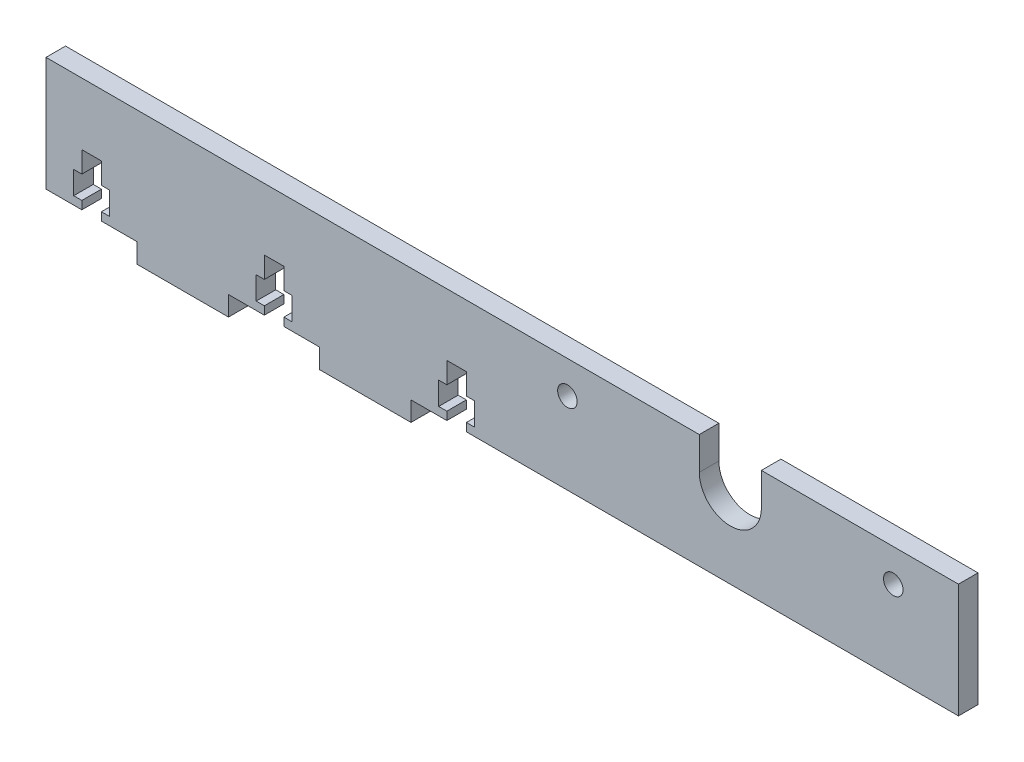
SolidWorks part; units mm, degrees
ref_plane "Front Plane" through (0, 0, 0) normal (0, 0, 1) x (1, 0, 0)
ref_plane "Top Plane" through (0, 0, 0) normal (0, 1, 0) x (1, 0, 0)
ref_plane "Right Plane" through (0, 0, 0) normal (1, 0, 0) x (0, 0, -1)
sketch "Sketch1" plane through (0, 0, 0) normal (0, 0, 1) x (1, 0, 0)
  line L1 (-35, -12.5) -> (35, -12.5)
  line L2 (-35, -12.5) -> (-35, 12.5)
  line L3 (-35, 12.5) -> (35, 12.5)
  line L4 (35, -12.5) -> (35, 12.5)
  line L5 (-35, -12.5) -> (35, 12.5) construction
  line L6 (-35, 12.5) -> (35, -12.5) construction
  line L7 (-35, 12.5) -> (35, 12.5)
  line L8 (-35, 12.5) -> (-35, 27.5)
  line L9 (-35, 27.5) -> (35, 27.5)
  line L10 (35, 12.5) -> (35, 27.5)
  line L11 (-5, 20) -> (5, 20)
  line L12 (-5, 20) -> (-5, 13)
  line L13 (-5, 13) -> (5, 13)
  line L14 (5, 20) -> (5, 13)
  line L15 (-5, 20) -> (5, 13) construction
  line L16 (-5, 13) -> (5, 20) construction
  circle A0 centre (0, 0) radius 4.7625
  circle A1 centre (-25, 0) radius 1.5
  circle A2 centre (25, 0) radius 1.5
  point P11 (0, 16.5)
  dimension "D1" = 9.525
  dimension "D2" = 3
  dimension "D3" = 3
  dimension "D6" = 25
  dimension "D4" = 25
  dimension "D5" = 70
  dimension "D7" = 25
  dimension "D8" = 15
  dimension "D9" = 10
  dimension "D10" = 7
  dimension "D11" = 20
extrude "Boss-Extrude1" add sketch "Sketch1" along normal blind 3 contours L1 L4 L3 L2 A2 A1 A0 | L3 L10 L9 L8 L11 L14 L13 L12
sketch "Sketch2" plane through (0, 0, 3) normal (0, 0, 1) x (1, 0, 0)
  point P26 (-21, 7)
other "Block1-1"
sketch_block "Block1" parameters "D7"=3, "D13"=3, "D1"=22, "D2"=13.85, "D3"=13.85, "D4"=3, "D5"=15, "D6"=15, "D8"=7, "D9"=7, "D10"=3, "D11"=10, "D12"=4, "D14"=3
extrude "Cut-Extrude1" cut sketch "Sketch2" against normal blind 10
sketch "Sketch3" plane through (0, 0, 3) normal (0, 0, 1) x (1, 0, 0)
  line L0 (-4.7625, 0) -> (4.7625, 0)
  line L1 (4.7625, 0) -> (4.7625, 5.5)
  line L2 (-4.7625, 0) -> (-4.7625, 5.0135)
  line L4 (-35, 27.5) -> (35, 27.5)
  line L5 (-35, 27.5) -> (-35, 5.0135)
  line L6 (-35, 5.0135) -> (35, 5.0135)
  line L7 (35, 27.5) -> (35, 5.0135)
  circle A0 centre (0, 0) radius 4.7625 construction
extrude "Cut-Extrude4" cut sketch "Sketch3" against normal blind 10
sketch "Sketch4" plane through (0, 0, 3) normal (0, 0, 1) x (1, 0, 0)
  line L0 (-35, -12.5) -> (35, -12.5) construction
  line L1 (-35, 5.0135) -> (-105, 5.0135)
  line L2 (-35, 5.0135) -> (-35, -12.5)
  line L3 (-35, -12.5) -> (-105, -12.5)
  line L4 (-105, 5.0135) -> (-105, -12.5)
  line L5 (-70, -1005.5426) -> (-70, 48994.4574) construction
  line L6 (-91, -12.5) -> (-77, -12.5)
  line L7 (-91, -12.5) -> (-91, -15.5)
  line L8 (-91, -15.5) -> (-77, -15.5)
  line L9 (-77, -12.5) -> (-77, -15.5)
  line L10 (-63, -12.5) -> (-49, -12.5)
  line L11 (-63, -12.5) -> (-63, -15.5)
  line L12 (-63, -15.5) -> (-49, -15.5)
  line L13 (-49, -12.5) -> (-49, -15.5)
  line L14 (-71.5, -12.5) -> (-68.5, -12.5)
  line L15 (-71.5, -12.5) -> (-71.5, -4.5)
  line L16 (-71.5, -4.5) -> (-68.5, -4.5)
  line L17 (-68.5, -12.5) -> (-68.5, -4.5)
  line L18 (-43.5, -12.5) -> (-40.5, -12.5)
  line L19 (-72.75, -11.25) -> (-67.25, -11.25)
  line L20 (-72.75, -11.25) -> (-72.75, -7.75)
  line L21 (-72.75, -7.75) -> (-67.25, -7.75)
  line L22 (-67.25, -11.25) -> (-67.25, -7.75)
  line L23 (-72.75, -11.25) -> (-67.25, -7.75) construction
  line L24 (-72.75, -7.75) -> (-67.25, -11.25) construction
  line L25 (-43.5, -12.5) -> (-43.5, -4.5)
  line L26 (-43.5, -4.5) -> (-40.5, -4.5)
  line L27 (-40.5, -12.5) -> (-40.5, -4.5)
  line L28 (-44.75, -11.25) -> (-39.25, -11.25)
  line L29 (-44.75, -11.25) -> (-44.75, -7.75)
  line L30 (-44.75, -7.75) -> (-39.25, -7.75)
  line L31 (-39.25, -11.25) -> (-39.25, -7.75)
  line L32 (-44.75, -11.25) -> (-39.25, -7.75) construction
  line L33 (-44.75, -7.75) -> (-39.25, -11.25) construction
  line L34 (-99.5, -12.5) -> (-96.5, -12.5)
  line L35 (-99.5, -12.5) -> (-99.5, -4.5)
  line L36 (-99.5, -4.5) -> (-96.5, -4.5)
  line L37 (-96.5, -12.5) -> (-96.5, -4.5)
  line L38 (-100.75, -11.25) -> (-95.25, -11.25)
  line L39 (-100.75, -11.25) -> (-100.75, -7.75)
  line L40 (-100.75, -7.75) -> (-95.25, -7.75)
  line L41 (-95.25, -11.25) -> (-95.25, -7.75)
  line L42 (-100.75, -11.25) -> (-95.25, -7.75) construction
  line L43 (-100.75, -7.75) -> (-95.25, -11.25) construction
  point P20 (-70, -9.5)
  point P22 (-70, -4.5)
  point P33 (-42, -9.5)
  point P41 (-98, -9.5)
  dimension "D1" = 70
  dimension "D2" = 3
  dimension "D3" = 14
  dimension "D4" = 14
  dimension "D5" = 14
  dimension "D6" = 14
  dimension "D7" = 3
  dimension "D8" = 7
  dimension "D9" = 8
  dimension "D10" = 5.5
  dimension "D11" = 3.5
  dimension "D12" = 3
  dimension "D13" = 2
  dimension "D14" = 2
extrude "Boss-Extrude2" add sketch "Sketch4" against normal blind 3 contours L41 L38 L37 L3 L15 L19 L20 L21 L16 L17 L22 L25 L28 L29 L30 L26 L27 L31 L1 L4 L35 L39 L40 L36 M14 | L13 L3 L11 L12 | L9 L3 L7 L8
